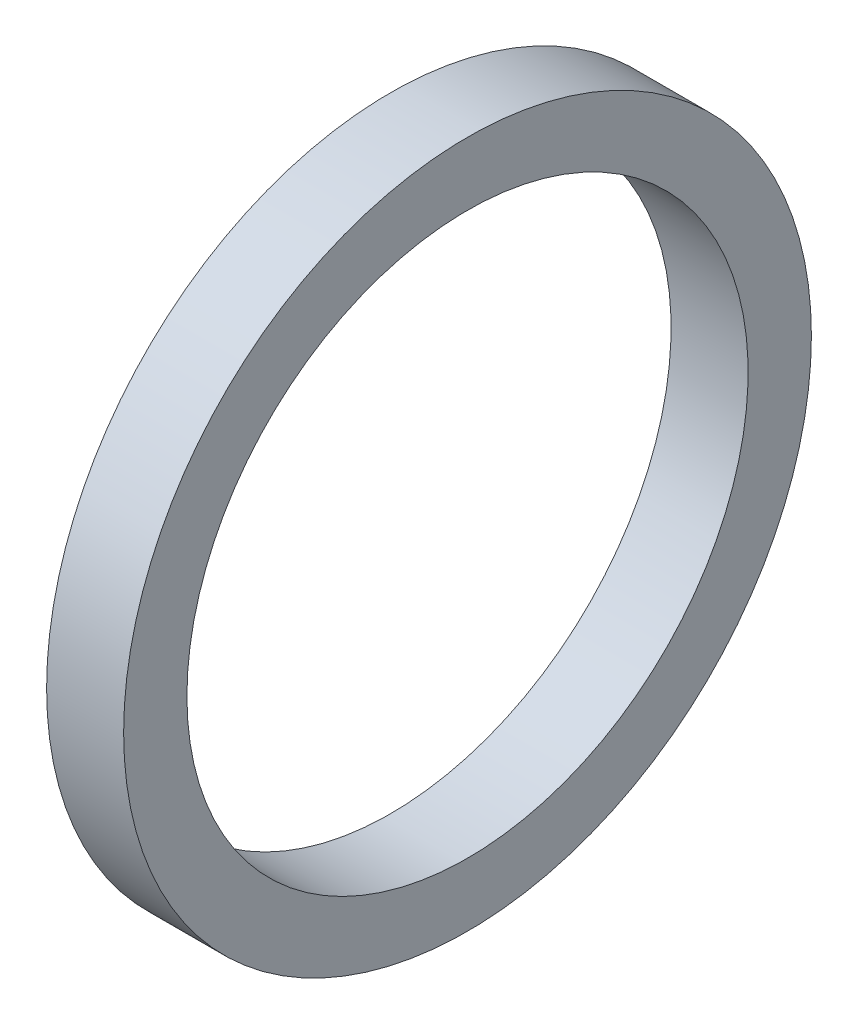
SolidWorks part; units mm, degrees
ref_plane "Plane1" through (0, 0, 0) normal (0, 0, 1) x (1, 0, 0)
ref_plane "Plane2" through (0, 0, 0) normal (0, 1, 0) x (1, 0, 0)
ref_plane "Plane3" through (0, 0, 0) normal (1, 0, 0) x (0, 0, -1)
other "Configuration Table"
sketch "Sketch1" plane through (0, 0, 0) normal (0, 0, 1) x (1, 0, 0)
  line L0 (-34.925, 0) -> (9.525, 0) construction
  line L1 (0, 51) -> (0, 62.5)
  line L2 (0, 62.5) -> (-14, 62.5)
  line L3 (-14, 62.5) -> (-14, 51)
  line L4 (-14, 51) -> (0, 51)
  dimension "Thickness" = 14
  dimension "Inside_dia" = 102
  dimension "Outside_dia" = 125
revolve "Base-Revolve" add sketch "Sketch1" angle 360 about L0
